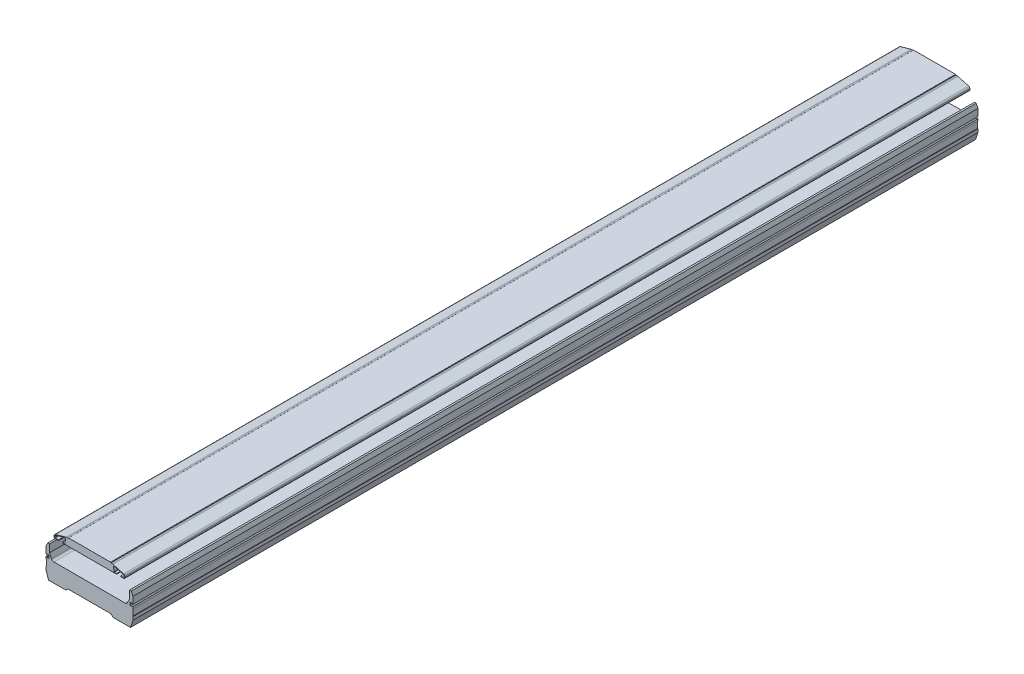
SolidWorks part; units mm, degrees
ref_plane "前视基准面" through (0, 0, 0) normal (0, 0, 1) x (1, 0, 0)
ref_plane "上视基准面" through (0, 0, 0) normal (0, 1, 0) x (1, 0, 0)
ref_plane "右视基准面" through (0, 0, 0) normal (1, 0, 0) x (0, 0, -1)
sketch "草图1" plane through (0, 0, 0) normal (0, 0, 1) x (1, 0, 0)
  line L0 (0, 0) -> (0, 72.5) construction
  line B0 (69.6454, 32) -> (-69.6454, 32)
  line B1 (-74.1769, 34.8869) -> (-78.1, 43.3)
  line B2 (-78.1, 43.3) -> (-78.1, 58.3)
  line B3 (-78.1, 58.3) -> (-81.5, 58.3)
  line B4 (-81.5, 58.3) -> (-85, 51.3)
  line B5 (-85, 51.3) -> (-85, 37.6)
  line B6 (-85, 37.6) -> (-83, 37.6)
  line B7 (-83, 37.6) -> (-83, 38.7)
  line B8 (-83, 38.7) -> (-80.2, 38.7)
  line B9 (-79.2, 37.7) -> (-79.2, 33.9)
  line B10 (-80.2, 32.9) -> (-83, 32.9)
  line B11 (-83, 32.9) -> (-83, 34)
  line B12 (-83, 34) -> (-85, 34)
  line B13 (-85, 34) -> (-85, 29.8)
  line B14 (-85, 29.8) -> (-84.5, 29.3)
  line B15 (-84.5, 29.3) -> (-84.5, 17.3)
  line B16 (-84.5, 17.3) -> (-85, 16.8)
  line B17 (-85, 16.8) -> (-85, 10.7)
  line B18 (-85, 10.7) -> (-80.1, -4)
  line B19 (-80.1, -4) -> (-46, -4)
  line B20 (-46, -4) -> (-42, 0)
  line B21 (-42, 0) -> (42, 0)
  line B22 (42, 0) -> (46, -4)
  line B23 (46, -4) -> (80.1, -4)
  line B24 (80.1, -4) -> (85, 10.7)
  line B25 (85, 10.7) -> (85, 16.8)
  line B26 (85, 16.8) -> (84.5, 17.3)
  line B27 (84.5, 17.3) -> (84.5, 29.3)
  line B28 (84.5, 29.3) -> (85, 29.8)
  line B29 (85, 29.8) -> (85, 34)
  line B30 (85, 34) -> (83, 34)
  line B31 (83, 34) -> (83, 32.9)
  line B32 (83, 32.9) -> (80.2, 32.9)
  line B33 (79.2, 33.9) -> (79.2, 37.7)
  line B34 (80.2, 38.7) -> (83, 38.7)
  line B35 (83, 38.7) -> (83, 37.6)
  line B36 (83, 37.6) -> (85, 37.6)
  line B37 (85, 37.6) -> (85, 51.3)
  line B38 (85, 51.3) -> (81.5, 58.3)
  line B39 (81.5, 58.3) -> (78.1, 58.3)
  line B40 (78.1, 58.3) -> (78.1, 43.3)
  line B41 (78.1, 43.3) -> (74.1769, 34.8869)
  arc B42 (-74.1769, 34.8869) -> (-69.6454, 32) centre (-69.6454, 37) ccw
  arc B43 (-79.2, 37.7) -> (-80.2, 38.7) centre (-80.2, 37.7) ccw
  arc B44 (-80.2, 32.9) -> (-79.2, 33.9) centre (-80.2, 33.9) ccw
  arc B45 (79.2, 33.9) -> (80.2, 32.9) centre (80.2, 33.9) ccw
  arc B46 (80.2, 38.7) -> (79.2, 37.7) centre (80.2, 37.7) ccw
  arc B47 (69.6454, 32) -> (74.1769, 34.8869) centre (69.6454, 37) ccw
  line B48 (41, 87) -> (-41, 87)
  line B49 (-42, 86) -> (-44.4254, 86)
  line B50 (-45.7616, 85.8182) -> (-66.6552, 80.0239)
  line B51 (-69, 76.9402) -> (-69, 74.5)
  line B52 (-67, 72.5) -> (-61, 72.5)
  line B53 (-61, 72.5) -> (-61, 73.7)
  line B54 (-61, 73.7) -> (-67, 73.7)
  line B55 (-67.8, 74.5) -> (-67.8, 76.9402)
  line B56 (-66.3345, 78.8675) -> (-49.6106, 83.5054)
  line B57 (-46.8846, 81.0074) -> (-48.1177, 74.3542)
  line B58 (-48.9043, 73.7) -> (-53, 73.7)
  line B59 (-53, 73.7) -> (-53, 72.5)
  line B60 (-53, 72.5) -> (53, 72.5)
  line B61 (53, 72.5) -> (53, 73.7)
  line B62 (53, 73.7) -> (48.9043, 73.7)
  line B63 (48.1177, 74.3542) -> (46.8846, 81.0074)
  line B64 (49.6106, 83.5054) -> (66.3345, 78.8675)
  line B65 (67.8, 76.9402) -> (67.8, 74.5)
  line B66 (67, 73.7) -> (61, 73.7)
  line B67 (61, 73.7) -> (61, 72.5)
  line B68 (61, 72.5) -> (67, 72.5)
  line B69 (69, 74.5) -> (69, 76.9402)
  line B70 (66.6552, 80.0239) -> (45.7616, 85.8182)
  line B71 (44.4254, 86) -> (42, 86)
  arc B72 (41.5, 86.5) -> (42, 86) centre (42, 86.5) ccw
  arc B73 (41.5, 86.5) -> (41, 87) centre (41, 86.5) ccw
  arc B74 (-41, 87) -> (-41.5, 86.5) centre (-41, 86.5) ccw
  arc B75 (-42, 86) -> (-41.5, 86.5) centre (-42, 86.5) ccw
  arc B76 (-44.4254, 86) -> (-45.7616, 85.8182) centre (-44.4254, 81) ccw
  arc B77 (-66.6552, 80.0239) -> (-69, 76.9402) centre (-65.8, 76.9402) ccw
  arc B78 (-69, 74.5) -> (-67, 72.5) centre (-67, 74.5) ccw
  arc B79 (-67.8, 74.5) -> (-67, 73.7) centre (-67, 74.5) ccw
  arc B80 (-66.3345, 78.8675) -> (-67.8, 76.9402) centre (-65.8, 76.9402) ccw
  arc B81 (-46.8846, 81.0074) -> (-49.6106, 83.5054) centre (-49.0281, 81.4047) ccw
  arc B82 (-48.9043, 73.7) -> (-48.1177, 74.3542) centre (-48.9043, 74.5) ccw
  arc B83 (48.1177, 74.3542) -> (48.9043, 73.7) centre (48.9043, 74.5) ccw
  arc B84 (49.6106, 83.5054) -> (46.8846, 81.0074) centre (49.0281, 81.4047) ccw
  arc B85 (67.8, 76.9402) -> (66.3345, 78.8675) centre (65.8, 76.9402) ccw
  arc B86 (67, 73.7) -> (67.8, 74.5) centre (67, 74.5) ccw
  arc B87 (67, 72.5) -> (69, 74.5) centre (67, 74.5) ccw
  arc B88 (69, 76.9402) -> (66.6552, 80.0239) centre (65.8, 76.9402) ccw
  arc B89 (45.7616, 85.8182) -> (44.4254, 86) centre (44.4254, 81) ccw
  dimension "D1" = 91
sketch_block_instance "块1-1"
sketch_block "块1"
sketch_block_instance "块2-1"
sketch_block "块2"
extrude "凸台-拉伸1" add sketch "草图1" along normal blind 1651
hole_wizard "打孔尺寸(%根据)内六角圆柱头螺钉的类型1" positions "草图2" profile "草图3" counterbore size "M8" standard "GB"
sketch "草图2" plane through (0, 58.3, 0) normal (0, 1, 0) x (1, 0, 0)
  line L0 (0, -1651) -> (0, -435.1793) construction
  line L1 (41, -1651) -> (-41, -1651) construction
  line L4 (46, -1651) -> (80.1, -1651) construction
  point P0 (70, -1577.5)
  point P9 (-70, -1577.5)
  point P16 (-70, -1377.5)
  point P18 (-70, -1177.5)
  point P20 (-70, -977.5)
  point P22 (-70, -777.5)
  point P24 (-70, -577.5)
  point P26 (-70, -177.5)
  point P28 (-70, -377.5)
  point P32 (70, -377.5)
  point P33 (70, -177.5)
  point P34 (70, -577.5)
  point P35 (70, -777.5)
  point P36 (70, -977.5)
  point P37 (70, -1177.5)
  point P38 (70, -1377.5)
  dimension "D1" = 140
  dimension "D2" = 73.5
  dimension "D3" = 200
  dimension "D4" = 200
  dimension "D5" = 200
  dimension "D6" = 200
  dimension "D7" = 200
  dimension "D8" = 200
  dimension "D9" = 200
sketch "草图3" plane through (70, 58.3, 1577.5) normal (1, 0, 0) x (0, 0, 1)
  line L0 (0, 0) -> (0, 62.3)
  line L1 (0, 62.3) -> (4.5, 62.3)
  line L3 (4.5, 62.3) -> (4.5, 48.3)
  line L4 (4.5, 48.3) -> (7.5, 48.3)
  line L5 (7.5, 48.3) -> (7.5, 0)
  line L7 (7.5, 0) -> (0, 0)
  line L11 (0, -6.35) -> (0, 107.95) construction
  dimension "通孔孔直径" = 9
  dimension "通孔孔深度" = 62.3
  dimension "柱形沉头孔直径" = 15
  dimension "柱形沉头孔深度" = 48.3
hole_wizard "M8 螺纹孔1" positions "草图4" profile "草图5" tap size "M8" standard "GB"
sketch "草图4" plane through (0, -4, 0) normal (0, -1, 0) x (-1, 0, 0)
  line L0 (0, -1651) -> (0, -1380.0153) construction
  line L1 (42, -1651) -> (-42, -1651) construction
  line L2 (80.1, -1651) -> (46, -1651) construction
  point P0 (70, -1592.5)
  point P2 (-70, -1592.5)
  point P12 (-70, -1392.5)
  point P14 (-70, -1192.5)
  point P16 (-70, -992.5)
  point P18 (-70, -792.5)
  point P20 (-70, -592.5)
  point P22 (-70, -392.5)
  point P24 (-70, -192.5)
  point P27 (70, -192.5)
  point P28 (70, -392.5)
  point P29 (70, -592.5)
  point P30 (70, -792.5)
  point P31 (70, -992.5)
  point P32 (70, -1192.5)
  point P33 (70, -1392.5)
  dimension "D1" = 140
  dimension "D2" = 58.5
  dimension "D3" = 200
  dimension "D4" = 200
  dimension "D5" = 200
  dimension "D6" = 200
  dimension "D7" = 200
  dimension "D8" = 200
  dimension "D9" = 200
sketch "草图5" plane through (-70, -4, 1592.5) normal (1, 0, 0) x (0, 0, -1)
  line L0 (0, 0) -> (0, 17.7929)
  line L1 (0, 17.7929) -> (3.4, 15.75)
  line L2 (3.4, 15.75) -> (3.4, 0)
  line L5 (3.4, 0) -> (0, 0)
  line L10 (0, 17.7929) -> (-3.4, 15.75) construction
  line L11 (0, -6.35) -> (0, 107.95) construction
  dimension "螺纹孔钻头直径" = 6.8
  dimension "螺纹孔钻头深度" = 15.75
  dimension "导头角度" = 118
